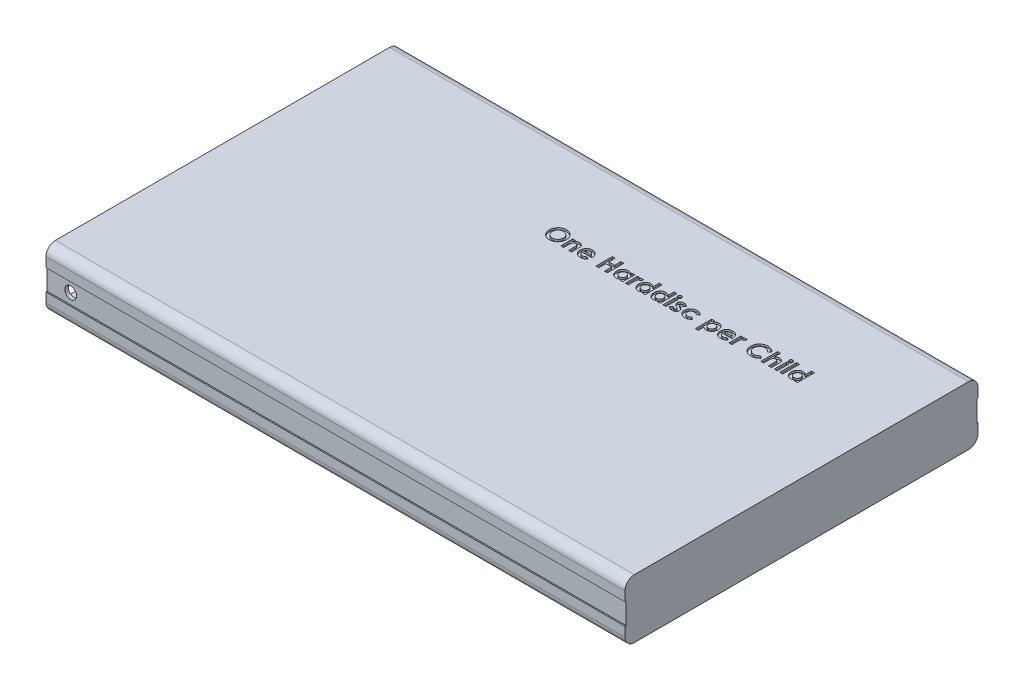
SolidWorks part; units mm, degrees
ref_plane "Front Plane" through (0, 0, 0) normal (0, 0, 1) x (1, 0, 0)
ref_plane "Top Plane" through (0, 0, 0) normal (0, 1, 0) x (1, 0, 0)
ref_plane "Right Plane" through (0, 0, 0) normal (1, 0, 0) x (0, 0, -1)
sketch "Skizze1" plane through (0, 0, 0) normal (1, 0, 0) x (0, 0, -1)
  line L0 (55, 0) -> (-55, 0) construction
  line L1 (-35.5, 10) -> (35.5, 10)
  line L2 (-37.5, 8) -> (-37.5, -0.5)
  line L3 (-35.5, -2.5) -> (35.5, -2.5)
  line L4 (37.5, 8) -> (37.5, -0.5)
  line L5 (0, 55) -> (0, -55) construction
  arc A0 (-35.5, 10) -> (-37.5, 8) centre (-35.5, 8) ccw
  arc A1 (37.5, 8) -> (35.5, 10) centre (35.5, 8) ccw
  arc A2 (-37.5, -0.5) -> (-35.5, -2.5) centre (-35.5, -0.5) ccw
  arc A3 (35.5, -2.5) -> (37.5, -0.5) centre (35.5, -0.5) ccw
  point P12 (37.5, 10)
  point P17 (37.5, -2.5)
  dimension "D5" = 2
  dimension "D6" = 2
  dimension "D7" = 2
  dimension "D1" = 12.5
  dimension "D2" = 10
  dimension "D3" = 37.5
  dimension "D4" = 37.5
extrude "Linear austragen2" add sketch "Skizze1" along normal blind 123
shell "Wandung2" thickness 1
sketch "Skizze4" plane through (0, 0, 37.5) normal (0, 0, 1) x (1, 0, 0)
  line L0 (123, 8) -> (123, -0.5) construction
  line L1 (-10, 6) -> (133, 6)
  line L2 (-10, 6) -> (-10, 1.5)
  line L3 (-10, 1.5) -> (133, 1.5)
  line L4 (133, 6) -> (133, 1.5)
  line L5 (0, 8) -> (0, -0.5) construction
  line L6 (123, -0.5) -> (0, -0.5) construction
  line L7 (123, 8) -> (0, 8) construction
  dimension "D1" = 10
  dimension "D2" = 10
  dimension "D3" = 2
  dimension "D4" = 2
extrude "Schnitt-Linear austragen1" cut sketch "Skizze4" against normal blind 0.25
sketch "Skizze5" plane through (0, 0, -37.5) normal (0, 0, -1) x (-1, 0, 0)
  line L0 (-123, 8) -> (0, 8) construction
  line L1 (-133, 6) -> (10, 6)
  line L2 (-133, 6) -> (-133, 1.5)
  line L3 (-133, 1.5) -> (10, 1.5)
  line L4 (10, 6) -> (10, 1.5)
  line L5 (-123, -0.5) -> (0, -0.5) construction
  line L6 (-123, -0.5) -> (-123, 8) construction
  line L8 (0, -0.5) -> (0, 8) construction
  dimension "D1" = 2
  dimension "D2" = 2
  dimension "D3" = 10
  dimension "D4" = 10
extrude "Schnitt-Linear austragen2" cut sketch "Skizze5" against normal blind 0.25
sketch "Skizze6" plane through (0, 0, -37.25) normal (0, 0, -1) x (-1, 0, 0)
  line L0 (0, 1.5) -> (0, 6) construction
  line L4 (-123, -2.5) -> (0, -2.5) construction
  circle A0 centre (-5, 3.75) radius 1.25
  dimension "D2" = 2.5
  dimension "D3" = 6.25
  dimension "D1" = 5
extrude "Schnitt-Linear austragen3" cut sketch "Skizze6" against normal through all
sketch "Skizze7"
extrude "Schnitt-Linear austragen4" cut sketch "Skizze7" against normal blind 0.4
